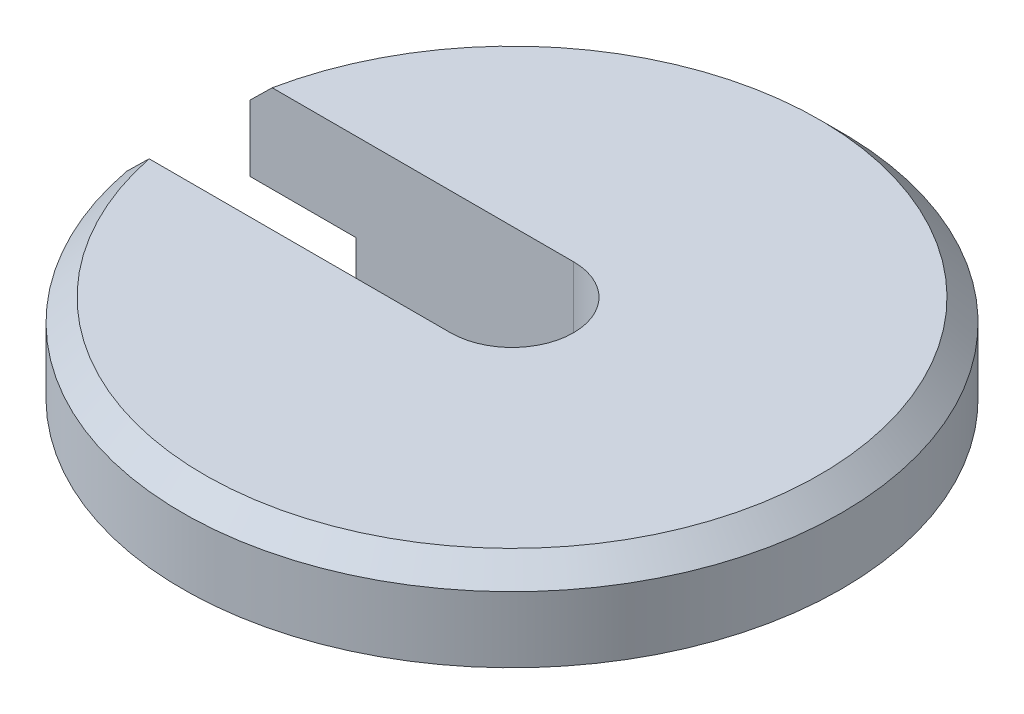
SolidWorks part; units mm, degrees
ref_plane "Plan de face" through (0, 0, 0) normal (0, 0, 1) x (1, 0, 0)
ref_plane "Plan de dessus" through (0, 0, 0) normal (0, 1, 0) x (1, 0, 0)
ref_plane "Plan de droite" through (0, 0, 0) normal (1, 0, 0) x (0, 0, -1)
sketch "Esquisse1" plane through (0, 0, 0) normal (0, 0, 1) x (1, 0, 0)
  line L0 (51.5, 395) -> (75, 395)
  line L1 (14, 415) -> (75, 415)
  line L2 (51.5, 385) -> (14, 385)
  line L3 (14, 385) -> (14, 415)
  line L4 (51.5, 395) -> (51.5, 385)
  line L5 (75, 395) -> (75, 415)
  line L6 (0, 427.0727) -> (0, 385) construction
  line L7 (53.5, 344) -> (53.5, 393.5) construction
  line L8 (78.5, 395) -> (-78.5, 395) construction
  dimension "D1" = 2
  dimension "D2" = 10
  dimension "D3" = 20
  dimension "D4" = 150
  dimension "D5" = 28
revolve "Révolution1" add sketch "Esquisse1" angle 360 about L6
chamfer "Chanfrein1" distance 5 angle 45 1 edges at (-75, 415, 0)
sketch "Esquisse2" plane through (0, 415, 0) normal (0, 1, 0) x (1, 0, 0)
  line L0 (0, -14) -> (-73.6817, -14)
  line L1 (0, 14) -> (-73.6817, 14)
  circle A0 centre (0, 0) radius 75 construction
  arc A1 (-73.6817, 14) -> (-73.6817, -14) centre (0, 0) ccw
  circle A2 centre (0, 0) radius 14 construction
  arc A3 (0, -14) -> (0, 14) centre (0, 0) ccw
extrude "Enlèv. mat.-Extru.1" cut sketch "Esquisse2" against normal up to next
